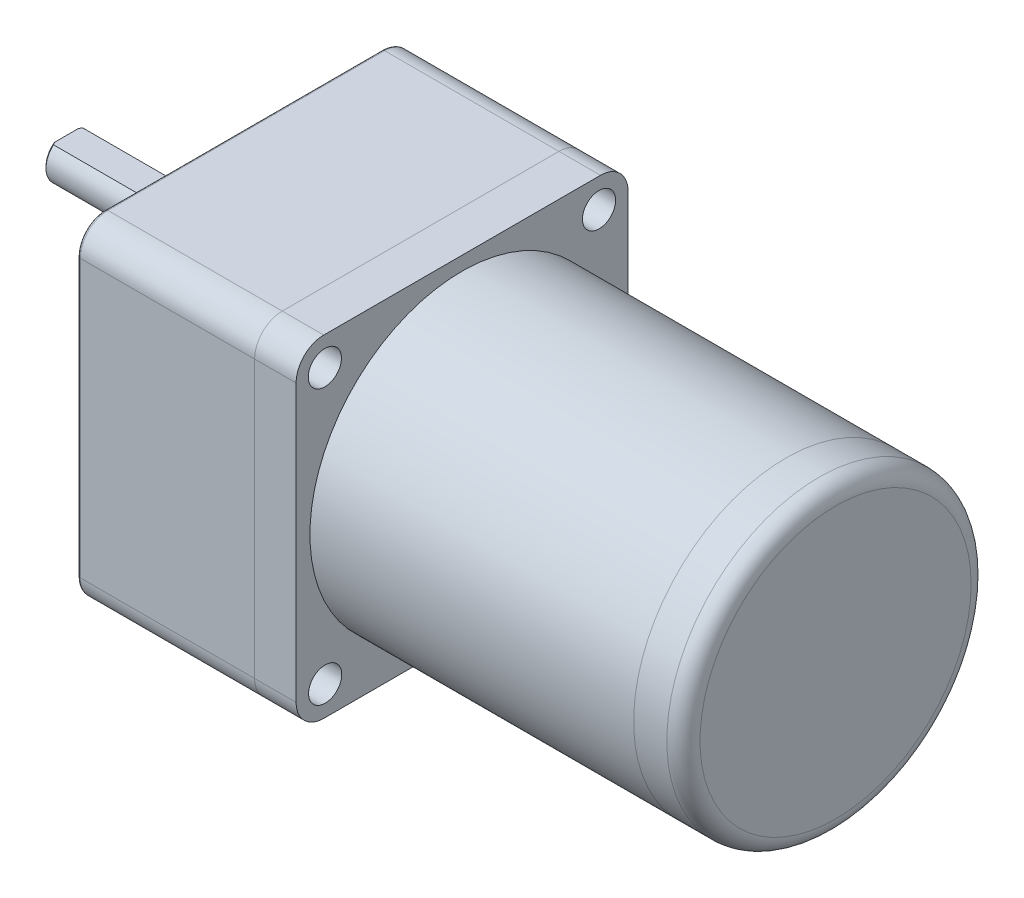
SolidWorks part; units mm, degrees
ref_plane "前视基准面" through (0, 0, 0) normal (0, 0, 1) x (1, 0, 0)
ref_plane "上视基准面" through (0, 0, 0) normal (0, 1, 0) x (1, 0, 0)
ref_plane "右视基准面" through (0, 0, 0) normal (1, 0, 0) x (0, 0, -1)
sketch "草图1" plane through (0, 0, 0) normal (1, 0, 0) x (0, 0, -1)
  line L1 (-25, -30) -> (25, -30)
  line L2 (-30, -25) -> (-30, 25)
  line L3 (-25, 30) -> (25, 30)
  line L4 (30, -25) -> (30, 25)
  line L5 (-30, -30) -> (30, 30) construction
  line L6 (-30, 30) -> (30, -30) construction
  arc A0 (-25, -30) -> (-30, -25) centre (-25, -25) cw
  arc A1 (25, -30) -> (30, -25) centre (25, -25) ccw
  arc A2 (25, 30) -> (30, 25) centre (25, 25) cw
  arc A3 (-30, 25) -> (-25, 30) centre (-25, 25) cw
  point P0 (0, 0)
  dimension "D1" = 5
extrude "凸台-拉伸1" add sketch "草图1" along normal blind 32
sketch "草图2" plane through (32, 0, 0) normal (1, 0, 0) x (0, 0, -1)
  line L0 (25, 30) -> (-25, 30) construction
  line L1 (-25, -30) -> (25, -30)
  line L2 (-30, -25) -> (-30, 25)
  line L3 (-25, 30) -> (25, 30)
  line L4 (30, -25) -> (30, 25)
  line L5 (-30, -30) -> (30, 30) construction
  line L6 (-30, 30) -> (30, -30) construction
  arc A0 (25, 30) -> (30, 25) centre (25, 25) cw
  arc A1 (25, -30) -> (30, -25) centre (25, -25) ccw
  arc A2 (-25, -30) -> (-30, -25) centre (-25, -25) cw
  arc A3 (-30, 25) -> (-25, 30) centre (-25, 25) cw
  point P0 (0, 0)
  dimension "D1" = 5
extrude "凸台-拉伸2" add sketch "草图2" along normal blind 7.5 separate body
sketch "草图3" plane through (39.5, 0, 0) normal (1, 0, 0) x (0, 0, -1)
  circle A0 centre (0, 0) radius 27.5
extrude "凸台-拉伸3" add sketch "草图3" along normal blind 58.5 separate body
sketch "草图4" plane through (98, 0, 0) normal (1, 0, 0) x (0, 0, -1)
  circle A0 centre (0, 0) radius 27.5
extrude "凸台-拉伸4" add sketch "草图4" along normal blind 9 separate body
fillet "圆角1" radius 3 1 edges at (107, 0, -27.5)
sketch "草图5" plane through (0, 0, 0) normal (-1, 0, 0) x (0, 0, 1)
  circle A0 centre (0, 10) radius 12
extrude "凸台-拉伸5" add sketch "草图5" along normal blind 3 separate body
sketch "草图6" plane through (-3, 0, 0) normal (-1, 0, 0) x (0, 0, 1)
  circle A0 centre (0, 10) radius 4
extrude "凸台-拉伸6" add sketch "草图6" along normal blind 29 separate body
fillet "圆角2" radius 0.5 1 edges at (-3, 10, 12)
sketch "草图7" plane through (-32, 0, 0) normal (-1, 0, 0) x (0, 0, 1)
  line L2 (2.6458, 13) -> (-2.6458, 13)
  arc A0 (2.6458, 13) -> (-2.6458, 13) centre (0, 10) ccw
extrude "切除-拉伸1" cut sketch "草图7" against normal blind 25
chamfer "倒角1" distance 0.3 angle 45 1 edges at (-32, 6, 0)
sketch "草图8" plane through (0, 0, 0) normal (-1, 0, 0) x (0, 0, 1)
  circle A0 centre (0, 0) radius 26.3
extrude "切除-拉伸2" cut sketch "草图8" against normal blind 0.5
fillet "圆角3" radius 0.5 1 edges at (0, 0, 26.3)
fillet "圆角4" radius 0.5 8 edges at (0, -30, 0) (0, -28.5355, -28.5355) (0, 0, -30) (0, 28.5355, -28.5355) (0, 30, 0) (0, 28.5355, 28.5355) (0, 0, 30) (0, -28.5355, 28.5355)
sketch "草图9" plane through (0, 0, 0) normal (-1, 0, 0) x (0, 0, 1)
  point P19 (-24.7487, 24.7487)
  point P20 (24.7487, 24.7487)
  point P21 (24.7487, -24.7487)
  point P22 (-24.7487, -24.7487)
hole_wizard "M4 螺纹孔1" positions "3D草图1" profile "草图10" tap size "M4" standard "GB"
sketch3d "3D草图1"
  point P0 (0, 24.7487, -24.7487)
  point P3 (0, 24.7487, 24.7487)
  point P6 (0, -24.7487, 24.7487)
  point P9 (0, -24.7487, -24.7487)
sketch "草图10" plane through (0, 24.7487, -24.7487) normal (0, 1, 0) x (0, 0, 1)
  line L0 (0, 0) -> (0, 12.9914)
  line L1 (0, 12.9914) -> (1.65, 12)
  line L2 (1.65, 12) -> (1.65, 0)
  line L5 (1.65, 0) -> (0, 0)
  line L10 (0, 12.9914) -> (-1.65, 12) construction
  line L11 (0, -6.35) -> (0, 107.95) construction
  dimension "螺纹孔钻头直径" = 3.3
  dimension "螺纹孔钻头深度" = 12
  dimension "导头角度" = 118
sketch "草图11" plane through (39.5, 0, 0) normal (1, 0, 0) x (0, 0, -1)
  circle A5 centre (-24.8007, 24.8007) radius 3
  circle A6 centre (24.7487, 24.7487) radius 3
  circle A7 centre (24.7487, -24.7487) radius 3
  circle A8 centre (-24.7487, -24.7487) radius 3
extrude "切除-拉伸3" cut sketch "草图11" against normal blind 27.5
